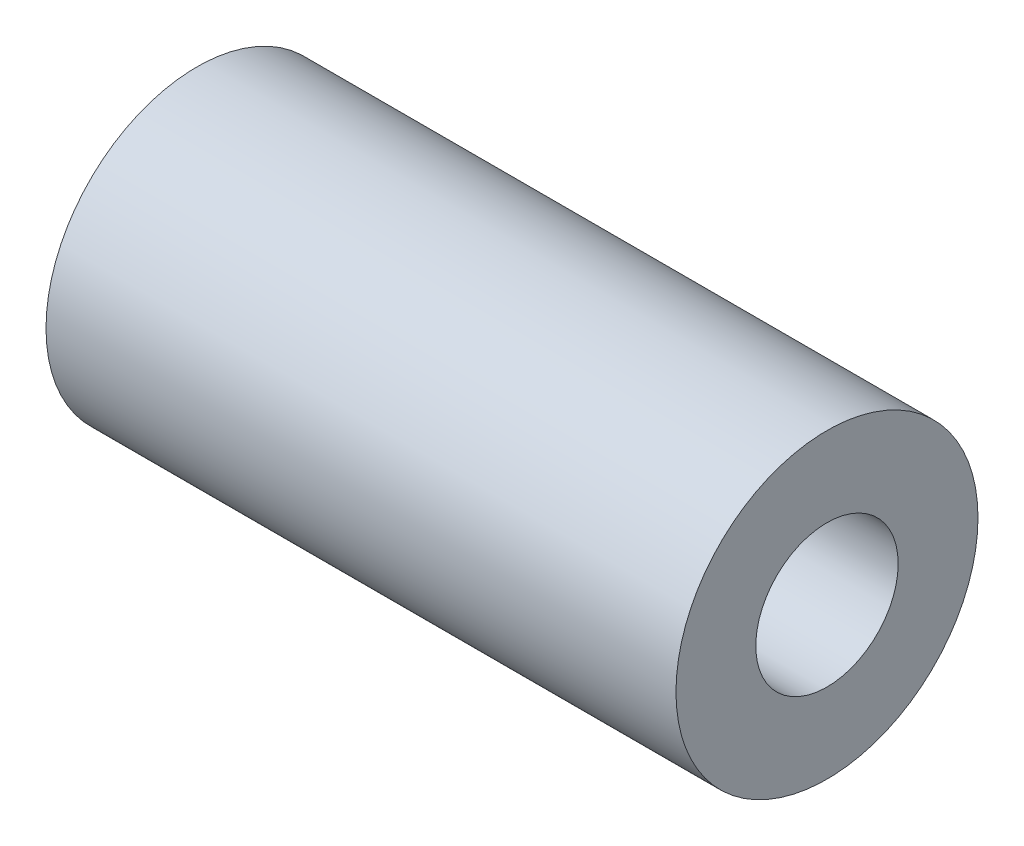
SolidWorks part; units mm, degrees
ref_plane "Front Plane" through (0, 0, 0) normal (0, 0, 1) x (1, 0, 0)
ref_plane "Top Plane" through (0, 0, 0) normal (0, 1, 0) x (1, 0, 0)
ref_plane "Right Plane" through (0, 0, 0) normal (1, 0, 0) x (0, 0, -1)
sketch "Sketch1" plane through (0, 0, 0) normal (1, 0, 0) x (0, 0, -1)
  circle A0 centre (0, 0) radius 3.5
  circle A1 centre (0, 0) radius 1.65
  dimension "D1" = 7
  dimension "D2" = 3.3
extrude "Boss-Extrude1" add sketch "Sketch1" along normal blind 14.6
